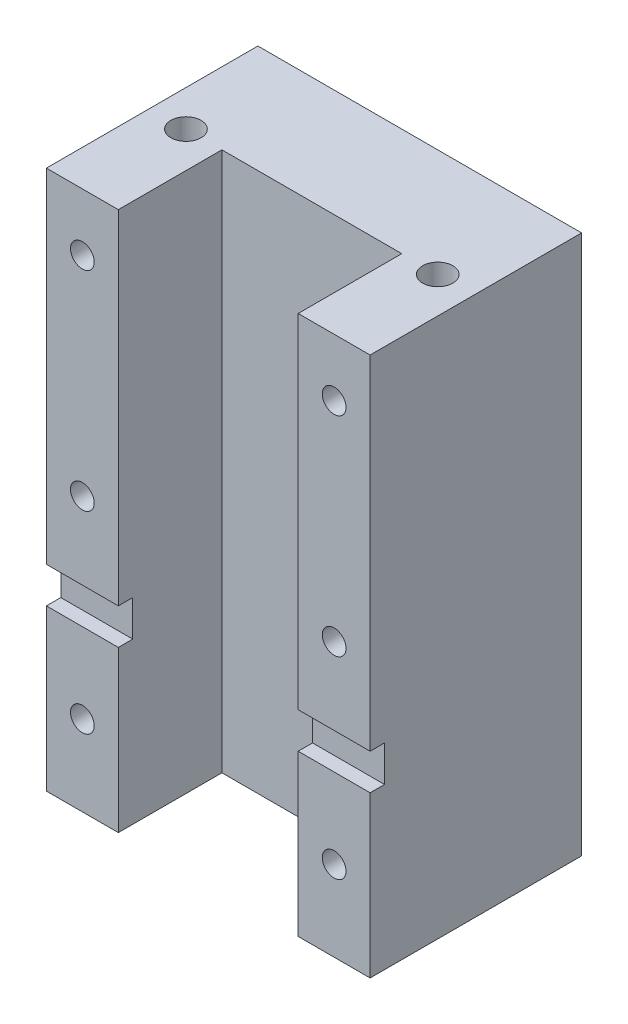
SolidWorks part; units mm, degrees
ref_plane "前视基准面" through (0, 0, 0) normal (0, 0, 1) x (1, 0, 0)
ref_plane "上视基准面" through (0, 0, 0) normal (0, 1, 0) x (1, 0, 0)
ref_plane "右视基准面" through (0, 0, 0) normal (1, 0, 0) x (0, 0, -1)
sketch "草图1" plane through (0, 0, 0) normal (0, 0, 1) x (1, 0, 0)
  line L0 (0, 0) -> (0, 75)
  line L1 (45, 0) -> (45, 75)
  line L2 (0, 0) -> (45, 0)
  line L3 (0, 75) -> (45, 75)
extrude "凸台-拉伸1" add sketch "草图1" along normal blind 29.4
sketch "草图2" plane through (45, 0, 0) normal (1, 0, 0) x (0, 0, -1)
  line L0 (-29.4, 27.3) -> (-27.4, 27.3)
  line L1 (-29.4, 22.3) -> (-27.4, 22.3)
  line L2 (-27.4, 22.3) -> (-27.4, 27.3)
extrude "切除-拉伸1" cut sketch "草图2" against normal through all and the other way through all
sketch "草图3" plane through (0, 75, 0) normal (0, 1, 0) x (1, 0, 0)
  line L0 (10, -29.4) -> (10, -15)
  line L1 (35, -29.4) -> (35, -15)
  line L2 (10, -15) -> (35, -15)
extrude "切除-拉伸2" cut sketch "草图3" against normal through all and the other way through all
sketch "草图4" plane through (0, 75, 0) normal (0, 1, 0) x (1, 0, 0)
  circle A0 centre (5, -15) radius 2.1
  circle A1 centre (40, -15) radius 2.1
extrude "切除-拉伸3" cut sketch "草图4" against normal through all
sketch "草图7" plane through (0, 0, 29.4) normal (0, 0, 1) x (1, 0, 0)
  circle A0 centre (5, 11.18) radius 1.65
  circle A1 centre (40, 11.18) radius 1.65
  circle A2 centre (5, 67) radius 1.65
  circle A3 centre (40, 67) radius 1.65
  circle A4 centre (40, 38) radius 1.65
  circle A5 centre (5, 38) radius 1.65
extrude "切除-拉伸4" cut sketch "草图7" against normal blind 12
